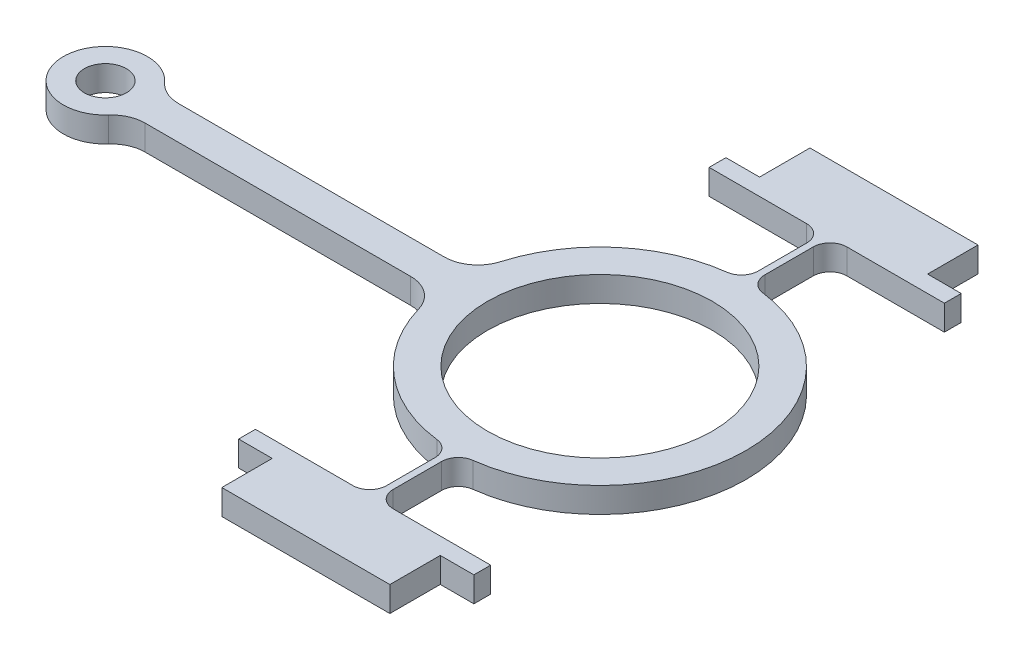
SolidWorks part; units mm, degrees
ref_plane "Front Plane" through (0, 0, 0) normal (0, 0, 1) x (1, 0, 0)
ref_plane "Top Plane" through (0, 0, 0) normal (0, 1, 0) x (1, 0, 0)
ref_plane "Right Plane" through (0, 0, 0) normal (1, 0, 0) x (0, 0, -1)
sketch "Sketch1" plane through (0, 0, 0) normal (0, 1, 0) x (1, 0, 0)
  line L1 (-0.25, 17.145) -> (0.25, 17.145)
  line L2 (-0.25, 17.145) -> (-0.25, 11.0372)
  line L3 (-0.25, 11.0372) -> (0.25, 11.0372)
  line L4 (0.25, 17.145) -> (0.25, 11.0372)
  line L5 (-0.25, 17.145) -> (0.25, 11.0372) construction
  line L6 (-0.25, 11.0372) -> (0.25, 17.145) construction
  line L7 (-0.25, -17.145) -> (0.25, -17.145)
  line L8 (-0.25, -17.145) -> (-0.25, -11.0372)
  line L9 (-0.25, -11.0372) -> (0.25, -11.0372)
  line L10 (0.25, -17.145) -> (0.25, -11.0372)
  line L11 (-0.25, -17.145) -> (0.25, -11.0372) construction
  line L12 (-0.25, -11.0372) -> (0.25, -17.145) construction
  line L13 (-6.35, 22.225) -> (6.35, 22.225)
  line L14 (-6.35, 22.225) -> (-6.35, 17.145)
  line L15 (-6.35, 17.145) -> (6.35, 17.145)
  line L16 (6.35, 22.225) -> (6.35, 17.145)
  line L17 (-6.35, 22.225) -> (6.35, 17.145) construction
  line L18 (-6.35, 17.145) -> (6.35, 22.225) construction
  line L19 (-6.35, -17.145) -> (6.35, -17.145)
  line L20 (-6.35, -17.145) -> (-6.35, -22.225)
  line L21 (-6.35, -22.225) -> (6.35, -22.225)
  line L22 (6.35, -17.145) -> (6.35, -22.225)
  line L23 (-6.35, -17.145) -> (6.35, -22.225) construction
  line L24 (-6.35, -22.225) -> (6.35, -17.145) construction
  line L25 (-37.3728, 1.27) -> (-10.9667, 1.27)
  line L26 (-37.3728, 1.27) -> (-37.3728, -1.27)
  line L27 (-37.3728, -1.27) -> (-10.9667, -1.27)
  line L28 (-10.9667, 1.27) -> (-10.9667, -1.27)
  line L29 (-37.3728, 1.27) -> (-10.9667, -1.27) construction
  line L30 (-37.3728, -1.27) -> (-10.9667, 1.27) construction
  circle A0 centre (0, 0) radius 8.5
  circle A1 centre (0, 0) radius 11.04
  point P4 (0, 14.0911)
  point P9 (0, -14.0911)
  point P14 (0, 19.685)
  point P19 (0, -19.685)
  point P24 (-24.1698, 0)
  dimension "D1" = 17
  dimension "D2" = 2.54
  dimension "D3" = 0.5
  dimension "D4" = 12.7
  dimension "D5" = 5.08
  dimension "D6" = 44.45
  dimension "D7" = 2.54
  dimension "D8" = 37.3728
sketch "Sketch2" plane through (0, 0, 0) normal (0, 1, 0) x (1, 0, 0)
  line L0 (0.25, 17.145) -> (6.35, 17.145)
  line L1 (-0.25, -17.145) -> (-6.35, -17.145)
  line L4 (-0.25, -17.145) -> (0.25, -17.145)
  line L5 (0.25, -17.145) -> (0.25, -11.0372)
  line L6 (0.25, -11.0372) -> (-0.25, -11.0372)
  line L7 (-0.25, -11.0372) -> (-0.25, -17.145)
  line L9 (0.25, -17.145) -> (0.25, -11.0372)
  line L11 (-0.25, -11.0372) -> (-0.25, -17.145)
  line L12 (0.25, 17.145) -> (-0.25, 17.145)
  line L13 (0.25, 11.0372) -> (0.25, 17.145)
  line L14 (-0.25, 11.0372) -> (0.25, 11.0372)
  line L15 (-0.25, 17.145) -> (-0.25, 11.0372)
  line L17 (0.25, 11.0372) -> (0.25, 17.145)
  line L19 (-0.25, 17.145) -> (-0.25, 11.0372)
  line L20 (-10.9667, 1.27) -> (-37.3728, 1.27)
  line L21 (-10.9667, -1.27) -> (-10.9667, 1.27)
  line L22 (-37.3728, -1.27) -> (-10.9667, -1.27)
  line L23 (-37.3728, 1.27) -> (-37.3728, -1.27)
  line L24 (-10.9667, 1.27) -> (-37.3728, 1.27)
  line L26 (-37.3728, -1.27) -> (-10.9667, -1.27)
  line L27 (-37.3728, 1.27) -> (-37.3728, -1.27)
  line L28 (6.35, -17.145) -> (-6.35, -17.145)
  line L29 (6.35, -22.225) -> (6.35, -17.145)
  line L30 (-6.35, -22.225) -> (6.35, -22.225)
  line L31 (-6.35, -17.145) -> (-6.35, -22.225)
  line L32 (6.35, -17.145) -> (0.25, -17.145)
  line L33 (6.35, -22.225) -> (6.35, -17.145)
  line L34 (-6.35, -22.225) -> (6.35, -22.225)
  line L35 (-6.35, -17.145) -> (-6.35, -22.225)
  line L36 (6.35, 22.225) -> (-6.35, 22.225)
  line L37 (6.35, 17.145) -> (6.35, 22.225)
  line L38 (-6.35, 17.145) -> (6.35, 17.145)
  line L39 (-6.35, 22.225) -> (-6.35, 17.145)
  line L40 (6.35, 22.225) -> (-6.35, 22.225)
  line L41 (6.35, 17.145) -> (6.35, 22.225)
  line L42 (-6.35, 17.145) -> (-0.25, 17.145)
  line L43 (-6.35, 22.225) -> (-6.35, 17.145)
  arc A0 (-10.9667, -1.27) -> (-0.25, -11.0372) centre (0, 0) ccw
  circle A1 centre (0, 0) radius 11.04
  arc A2 (-0.25, 11.0372) -> (-10.9667, 1.27) centre (0, 0) ccw
  circle A3 centre (0, 0) radius 8.5
  circle A4 centre (0, 0) radius 8.5
  arc A5 (0.25, -11.0372) -> (0.25, 11.0372) centre (0, 0) ccw
  dimension "D1" = 0
  dimension "D2" = 0
  dimension "D3" = 0
  dimension "D4" = 0
  dimension "D5" = 0
  dimension "D6" = 0
  dimension "D7" = 0
extrude "Boss-Extrude1" add sketch "Sketch2" along normal mid plane 1.9
fillet "Fillet1" radius 1.27 8 edges at (-0.25, 0, 17.145) (0.25, 0, 17.145) (0.25, 0, 11.0372) (-0.25, 0, 11.0372) (-0.25, 0, -17.145) (-0.25, 0, -11.0372) (0.25, 0, -11.0372) (0.25, 0, -17.145)
sketch "Sketch3" plane through (0, 0.95, 0) normal (0, 1, 0) x (1, 0, 0)
  line L0 (-37.3728, 1.27) -> (-37.3728, -1.27) construction
  circle A0 centre (-37.3728, 0) radius 3.175
  dimension "D1" = 6.35
extrude "Boss-Extrude2" add sketch "Sketch3" against normal up to surface (1.9 mm away)
sketch "Sketch4" plane through (0, 0.95, 0) normal (0, 1, 0) x (1, 0, 0)
  circle A0 centre (-37.3728, 0) radius 1.5875
  dimension "D1" = 3.175
extrude "Cut-Extrude1" cut sketch "Sketch4" against normal through all
sketch "Sketch5" plane through (0, 0.95, 0) normal (0, 1, 0) x (1, 0, 0)
  line L0 (1.52, 17.145) -> (6.35, 17.145) construction
  line L1 (-8.89, 18.415) -> (8.89, 18.415)
  line L2 (-8.89, 18.415) -> (-8.89, 17.145)
  line L3 (-8.89, 17.145) -> (8.89, 17.145)
  line L4 (8.89, 18.415) -> (8.89, 17.145)
  line L5 (-8.89, 18.415) -> (8.89, 17.145) construction
  line L6 (-8.89, 17.145) -> (8.89, 18.415) construction
  line L7 (6.35, 17.145) -> (6.35, 22.225) construction
  point P0 (0, 17.78)
  dimension "D1" = 2.54
  dimension "D2" = 1.27
extrude "Boss-Extrude3" add sketch "Sketch5" against normal up to surface (1.9 mm away)
mirror "Mirror1" about plane through (0, 0, 0) normal (0, 0, 1) of "Boss-Extrude3"
fillet "Fillet2" radius 2.54 4 edges at (-10.9667, 0, 1.27) (-10.9667, 0, -1.27) (-34.4629, 0, -1.27) (-34.4629, 0, 1.27)
